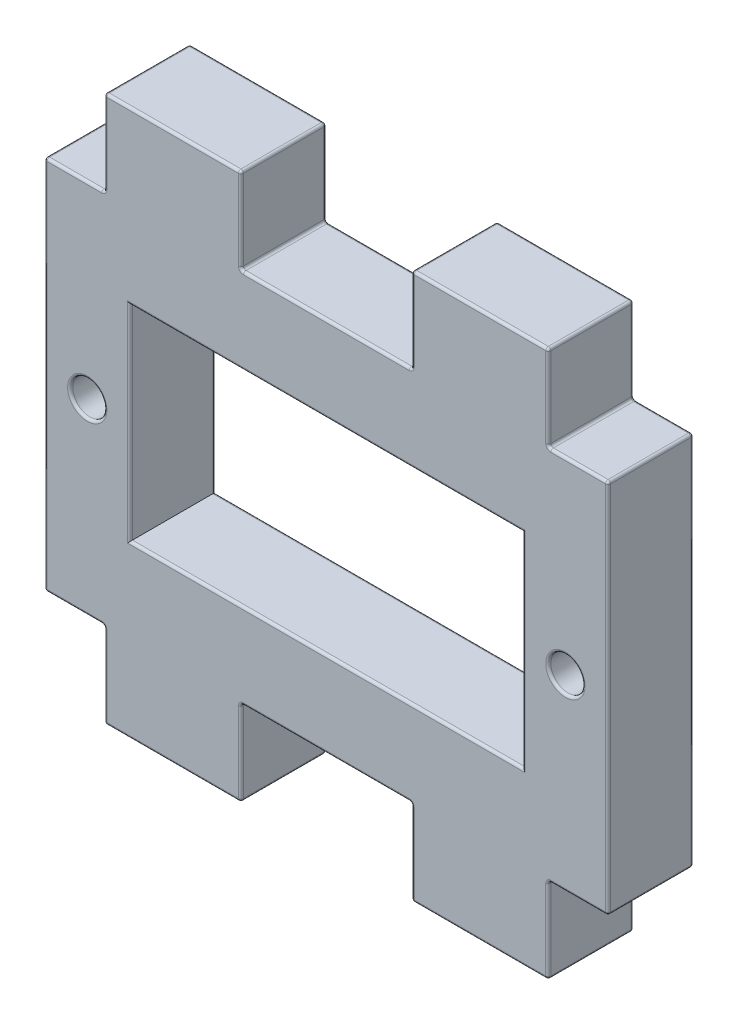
SolidWorks part; units mm, degrees
ref_plane "Front Plane" through (0, 0, 0) normal (0, 0, 1) x (1, 0, 0)
ref_plane "Top Plane" through (0, 0, 0) normal (0, 1, 0) x (1, 0, 0)
ref_plane "Right Plane" through (0, 0, 0) normal (1, 0, 0) x (0, 0, -1)
sketch "Sketch1" plane through (0, 0, 0) normal (0, 0, 1) x (1, 0, 0)
  line L0 (16.5, 11) -> (-16.5, 11)
  line L1 (11.5, -6) -> (-11.5, -6)
  line L2 (11.5, -6) -> (11.5, 6)
  line L3 (11.5, 6) -> (-11.5, 6)
  line L4 (-11.5, -6) -> (-11.5, 6)
  line L5 (11.5, -6) -> (-11.5, 6) construction
  line L6 (11.5, 6) -> (-11.5, -6) construction
  line L7 (-16.5, -11) -> (-16.5, 11)
  line L8 (16.5, -11) -> (-16.5, -11)
  line L9 (16.5, -11) -> (16.5, 11)
  line L10 (0, 6) -> (0, 0) construction
  line L12 (-13, 11) -> (-13, 16)
  line L13 (-13, 16) -> (-5, 16)
  line L14 (-5, 11) -> (-5, 16)
  line L15 (0, 0) -> (-16.5, 0) construction
  line L16 (5, 11) -> (5, 16)
  line L17 (13, 16) -> (5, 16)
  line L18 (13, 11) -> (13, 16)
  line L19 (13, -11) -> (13, -16)
  line L20 (13, -16) -> (5, -16)
  line L21 (5, -11) -> (5, -16)
  line L22 (-5, -11) -> (-5, -16)
  line L23 (-13, -16) -> (-5, -16)
  line L24 (-13, -11) -> (-13, -16)
  circle A0 centre (-14, 0) radius 1
  circle A1 centre (14, 0) radius 1
  point P0 (0, 0)
  point P29 (-11.5, 0)
  dimension "D7" = 2
  dimension "D1" = 12
  dimension "D2" = 23
  dimension "D4" = 3.5
  dimension "D5" = 5
  dimension "D6" = 8
  dimension "D8" = 2.5
  dimension "D3" = 5
extrude "Boss-Extrude1" add sketch "Sketch1" along normal mid plane 5 contours L8 L9 L0 L7 L1 L4 L3 L2 A0 A1 | L0 L14 L13 L12 | L0 L18 L17 L16 | L8 L24 L23 L22 | L8 L21 L20 L19
fillet "Fillet1" radius 0.15 60 edges at (-13, 16, 0) (-9, 16, -2.5) (-13, 13.5, -2.5) (-9, 16, 2.5) (-5, 16, 0) (-13, 13.5, 2.5) (-13, 11, 0) (-5, 13.5, -2.5) (-14.75, 11, -2.5) (-5, 13.5, 2.5) (-5, 11, 0) (-16.5, 11, 0) (-14.75, 11, 2.5) (0, 11, -2.5) (-16.5, 0, -2.5) (0, 11, 2.5) (5, 11, 0) (-16.5, 0, 2.5) (-16.5, -11, 0) (5, 13.5, -2.5) (-14.75, -11, -2.5) (5, 13.5, 2.5) (5, 16, 0) (-14.75, -11, 2.5) (-13, -11, 0) (9, 16, -2.5) (-13, -13.5, -2.5) (9, 16, 2.5) (13, 16, 0) (-13, -16, 0) (-13, -13.5, 2.5) (13, 13.5, -2.5) (-9, -16, -2.5) (13, 13.5, 2.5) (13, 11, 0) (-5, -16, 0) (-9, -16, 2.5) (14.75, 11, -2.5) (-5, -13.5, -2.5) (14.75, 11, 2.5) (16.5, 11, 0) (-5, -13.5, 2.5) (-5, -11, 0) (16.5, 0, -2.5) (0, -11, -2.5) (16.5, 0, 2.5) (16.5, -11, 0) (0, -11, 2.5) (5, -11, 0) (14.75, -11, -2.5) (5, -13.5, -2.5) (14.75, -11, 2.5) (13, -11, 0) (5, -16, 0) (5, -13.5, 2.5) (13, -13.5, -2.5) (9, -16, -2.5) (13, -13.5, 2.5) (9, -16, 2.5) (13, -16, 0)
fillet "Fillet2" radius 0.15 12 edges at (15, 0, -2.5) (-13, 0, -2.5) (-11.5, 0, -2.5) (0, 6, -2.5) (11.5, 0, -2.5) (0, -6, -2.5) (11.5, 0, 2.5) (0, 6, 2.5) (-11.5, 0, 2.5) (0, -6, 2.5) (-13, 0, 2.5) (15, 0, 2.5)
